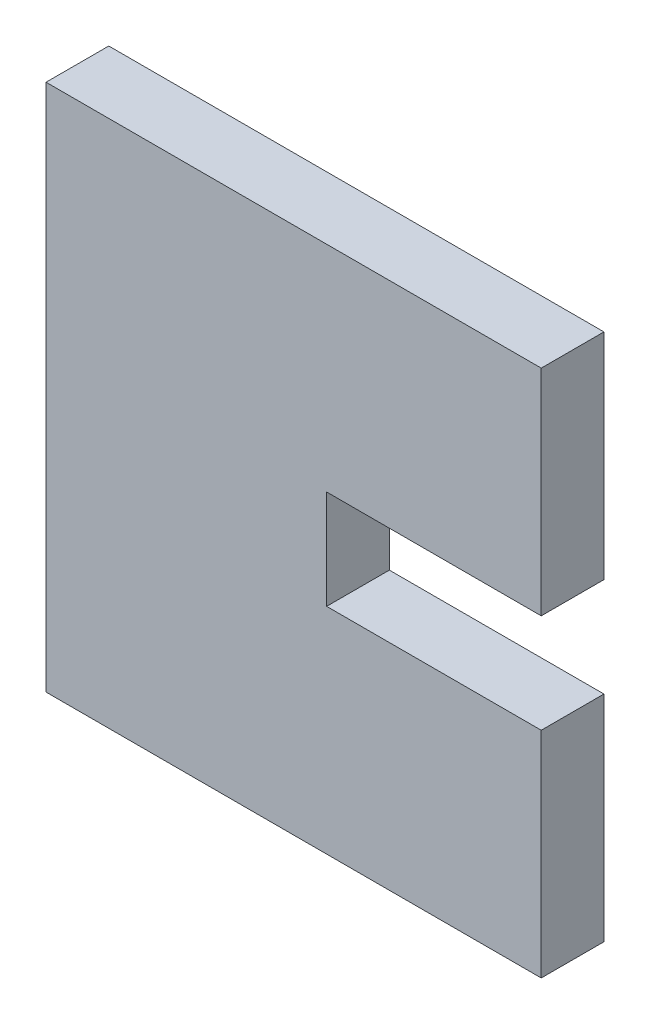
SolidWorks part; units mm, degrees
ref_plane "Ebene vorne" through (0, 0, 0) normal (0, 0, 1) x (1, 0, 0)
ref_plane "Ebene oben" through (0, 0, 0) normal (0, 1, 0) x (1, 0, 0)
ref_plane "Ebene rechts" through (0, 0, 0) normal (1, 0, 0) x (0, 0, -1)
sketch "Skizze2" plane through (0, 0, 0) normal (0, 0, 1) x (1, 0, 0)
  line L0 (-32, -16) -> (-32, 16)
  line L1 (-32, 16) -> (-2, 16)
  line L2 (-2, 16) -> (-2, 3)
  line L3 (-2, 3) -> (-15, 3)
  line L4 (-15, 3) -> (-15, -3)
  line L5 (-15, 0) -> (-32, 0)
  line L6 (-53.4415, 0) -> (66.6659, 0) construction
  line L7 (-2, -3) -> (-15, -3)
  line L8 (-2, -16) -> (-2, -3)
  line L9 (-32, -16) -> (-2, -16)
  dimension "D1" = 30
  dimension "D2" = 16
  dimension "D3" = 13
  dimension "D4" = 17
  dimension "D5" = 2
extrude "Aufsatz-Linear austragen1" add sketch "Skizze2" along normal blind 4 contours L2 L3 L4 L7 L8 L9 L0 L1
chamfer "Fase1" distance 0.2 angle 45 8 edges at (-32, 0, 0) (-17, -16, 0) (-2, -9.5, 0) (-8.5, -3, 0) (-15, 0, 0) (-8.5, 3, 0) (-2, 9.5, 0) (-17, 16, 0)
